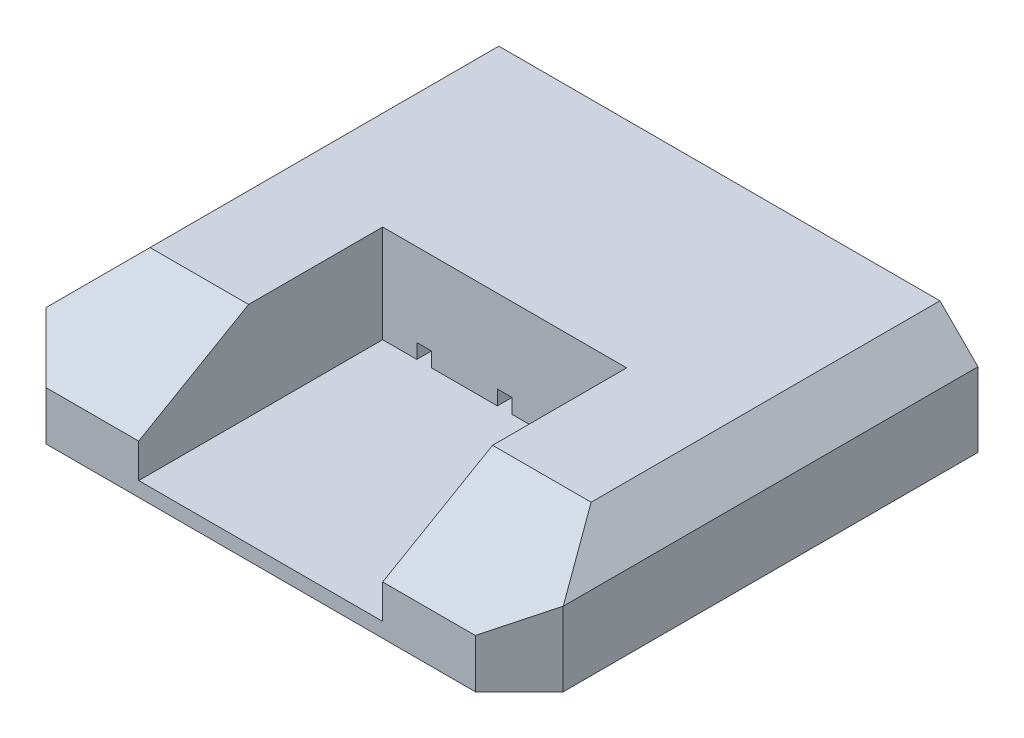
SolidWorks part; units mm, degrees
ref_plane "前视基准面" through (0, 0, 0) normal (0, 0, 1) x (1, 0, 0)
ref_plane "上视基准面" through (0, 0, 0) normal (0, 1, 0) x (1, 0, 0)
ref_plane "右视基准面" through (0, 0, 0) normal (1, 0, 0) x (0, 0, -1)
other "Configuration Table"
sketch "草图1" plane through (0, 0, 0) normal (0, 1, 0) x (1, 0, 0)
  line L1 (-530, -470) -> (530, -470)
  line L2 (-530, -470) -> (-530, 470)
  line L3 (-530, 470) -> (530, 470)
  line L4 (530, -470) -> (530, 470)
  line L5 (-530, -470) -> (530, 470) construction
  line L6 (-530, 470) -> (530, -470) construction
  point P0 (0, 0)
  dimension "D1" = 1060
  dimension "D2" = 940
extrude "凸台-拉伸1" add sketch "草图1" along normal blind 230
sketch "草图2" plane through (0, 230, 0) normal (0, 1, 0) x (1, 0, 0)
  line L0 (-530, -470) -> (530, -470) construction
  line L1 (-250, -470) -> (250, -470)
  line L2 (-250, -470) -> (-250, 30)
  line L3 (-250, 30) -> (250, 30)
  line L4 (250, -470) -> (250, 30)
  line L5 (-250, -470) -> (250, 30) construction
  line L6 (-250, 30) -> (250, -470) construction
  point P0 (0, -220)
  point P7 (0, 0)
  dimension "D1" = 500
  dimension "D2" = 500
extrude "切除-拉伸1" cut sketch "草图2" against normal blind 200
chamfer "倒角1" distance 90 2 edges at (-530, 115, 470) (530, 115, 470)
chamfer "倒角2" distance 130 angle 60 2 edges at (-345, 230, 470) (345, 230, 470)
chamfer "倒角3" distance 78 angle 45 2 edges at (-530, 230, -112.5833) (530, 230, -112.5833)
sketch "草图3" plane through (0, 0, -30) normal (0, 0, 1) x (1, 0, 0)
  line L0 (-15, 30) -> (-15, 60)
  line L1 (-180, 30) -> (-150, 30)
  line L2 (-180, 30) -> (-180, 60)
  line L3 (-180, 60) -> (-150, 60)
  line L4 (-150, 30) -> (-150, 60)
  line L5 (-180, 30) -> (-150, 60) construction
  line L6 (-180, 60) -> (-150, 30) construction
  line L7 (-15, 30) -> (15, 30)
  line L8 (15, 30) -> (15, 60)
  line L9 (-15, 60) -> (15, 60)
  line L10 (150, 30) -> (150, 60)
  line L11 (150, 30) -> (180, 30)
  line L12 (180, 30) -> (180, 60)
  line L13 (150, 60) -> (180, 60)
  line L14 (-180, 30) -> (-15, 30) construction
  line L15 (-250, 30) -> (250, 30) construction
  point P0 (-165, 45)
  dimension "D2" = 165
  dimension "D3" = 30
  dimension "D4" = 30
  dimension "D5" = 15
  dimension "D1" = 3
extrude "切除-拉伸2" cut sketch "草图3" against normal blind 50
